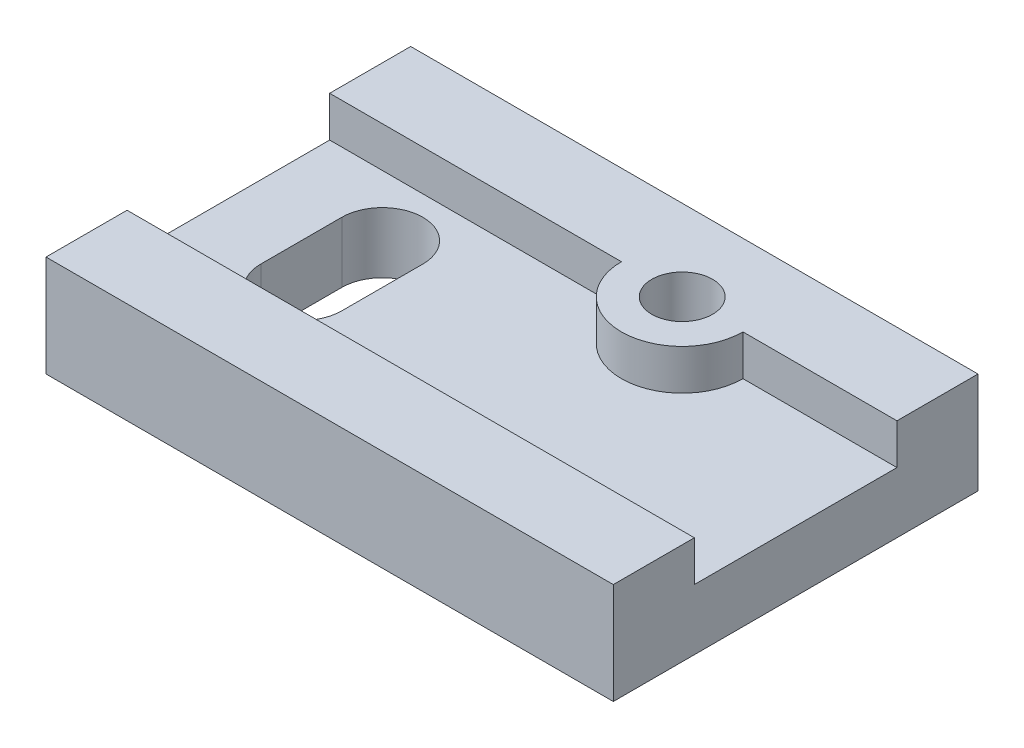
SolidWorks part; units mm, degrees
ref_plane "前视基准面" through (0, 0, 0) normal (0, 0, 1) x (1, 0, 0)
ref_plane "上视基准面" through (0, 0, 0) normal (0, 1, 0) x (1, 0, 0)
ref_plane "右视基准面" through (0, 0, 0) normal (1, 0, 0) x (0, 0, -1)
sketch "草图1" plane through (0, 0, 0) normal (0, 1, 0) x (1, 0, 0)
  line L1 (0, 0) -> (-140, 0)
  line L2 (0, 0) -> (0, -90)
  line L3 (0, -90) -> (-140, -90)
  line L4 (-140, 0) -> (-140, -90)
  dimension "D1" = 140
  dimension "D2" = 90
extrude "拉伸1" add sketch "草图1" along normal blind 25
sketch "草图2" plane through (0, 25, 0) normal (0, 1, 0) x (1, 0, 0)
  line L0 (-140, -20) -> (-68, -20)
  line L1 (-140, 0) -> (-140, -90) construction
  line L2 (-38, -20) -> (0, -20)
  line L3 (0, -90) -> (0, 0) construction
  line L4 (0, -20) -> (0, -70)
  line L5 (0, -70) -> (-140, -70)
  line L6 (-140, -70) -> (-140, -20)
  line L7 (-140, -45) -> (5.9898, -45) construction
  arc A0 (-68, -20) -> (-38, -20) centre (-53, -20) ccw
  dimension "D2" = 15
  dimension "D1" = 50
  dimension "D3" = 38
extrude "切除-拉伸1" cut sketch "草图2" against normal blind 10
sketch "草图3" plane through (0, 25, 0) normal (0, 1, 0) x (1, 0, 0)
  circle A0 centre (-53, -20) radius 7.5
  arc A1 (-68, -20) -> (-38, -20) centre (-53, -20) ccw construction
  dimension "D1" = 15
extrude "切除-拉伸2" cut sketch "草图3" against normal through all
sketch "草图4" plane through (0, 15, 0) normal (0, 1, 0) x (1, 0, 0)
  line L0 (-112, -95.5109) -> (-112, -6.5581) construction
  line L1 (-122, -35) -> (-122, -55)
  line L2 (-102, -55) -> (-102, -35)
  line L3 (-140, -20) -> (-140, -70) construction
  line L4 (-140, -45) -> (-61.954, -45) construction
  arc A0 (-122, -55) -> (-102, -55) centre (-112, -55) ccw
  arc A1 (-102, -35) -> (-122, -35) centre (-112, -35) ccw
  dimension "D3" = 10
  dimension "D1" = 28
  dimension "D2" = 20
extrude "切除-拉伸3" cut sketch "草图4" against normal through all
